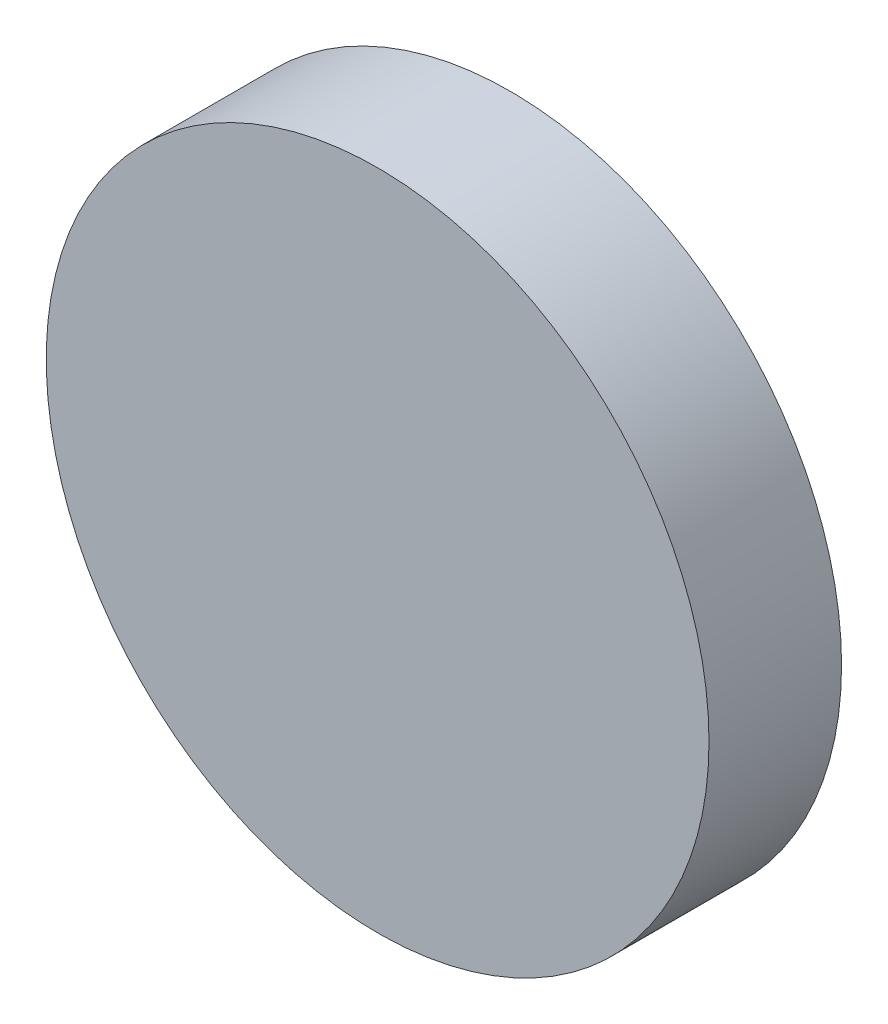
SolidWorks part; units mm, degrees
ref_plane "Front Plane" through (0, 0, 0) normal (0, 0, 1) x (1, 0, 0)
ref_plane "Top Plane" through (0, 0, 0) normal (0, 1, 0) x (1, 0, 0)
ref_plane "Right Plane" through (0, 0, 0) normal (1, 0, 0) x (0, 0, -1)
sketch "Sketch1" plane through (0, 0, 0) normal (0, 0, 1) x (1, 0, 0)
  circle A0 centre (0, 0) radius 31.75
  dimension "D1" = 63.5
extrude "Extrude1" add sketch "Sketch1" along normal blind 12.7
